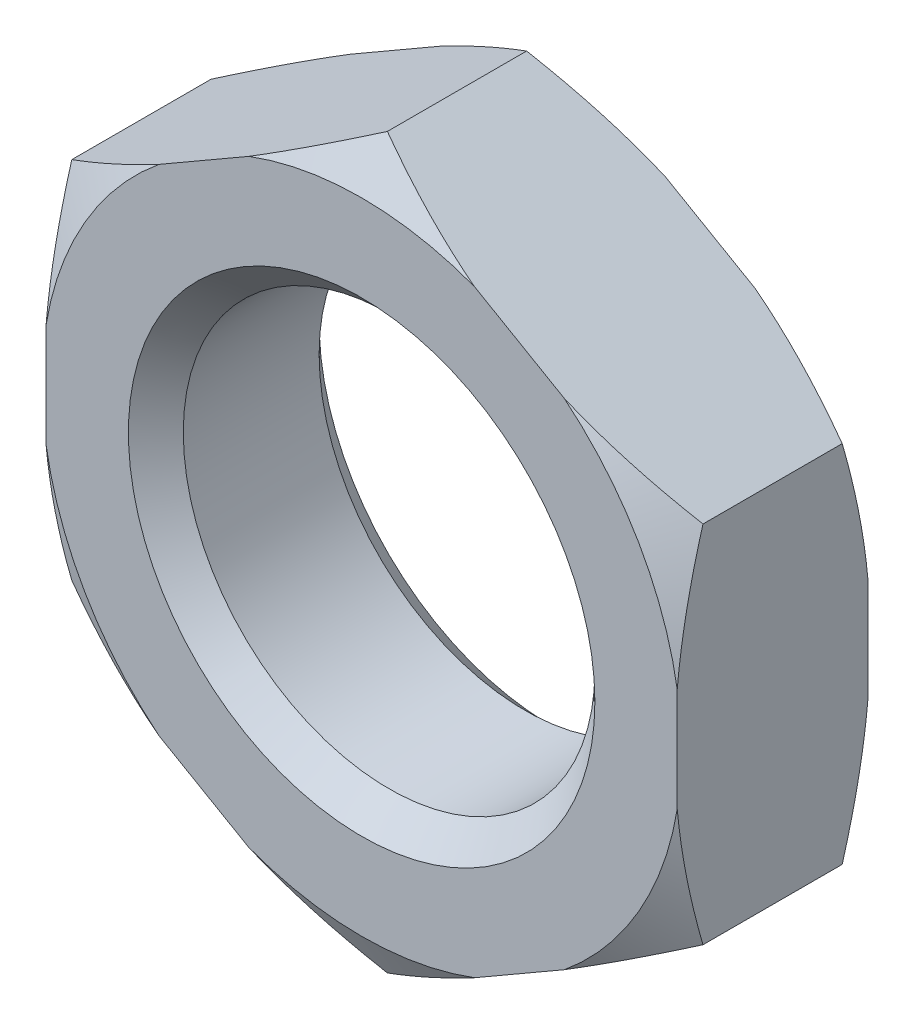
SolidWorks part; units mm, degrees
ref_plane "Front Plane" through (0, 0, 0) normal (0, 0, 1) x (1, 0, 0)
ref_plane "Top Plane" through (0, 0, 0) normal (0, 1, 0) x (1, 0, 0)
ref_plane "Right Plane" through (0, 0, 0) normal (1, 0, 0) x (0, 0, -1)
sketch "Sketch3" plane through (0, 0, 0) normal (0, 0, 1) x (1, 0, 0)
  line L1 (0, 26.5581) -> (-23, 13.2791)
  line L2 (-23, 13.2791) -> (-23, -13.2791)
  line L3 (-23, -13.2791) -> (0, -26.5581)
  line L4 (0, -26.5581) -> (23, -13.2791)
  line L5 (23, -13.2791) -> (23, 13.2791)
  line L6 (23, 13.2791) -> (0, 26.5581)
  circle A0 centre (0, 0) radius 23 construction
  dimension "D1" = 46
extrude "Boss-Extrude1" add sketch "Sketch3" along normal mid plane 13.9
sketch "Sketch4" plane through (0, 0, 0) normal (1, 0, 0) x (0, 0, -1)
  line L0 (-5.4578, 0) -> (6.1545, 0) construction
sketch "Sketch5" plane through (0, 0, 0) normal (1, 0, 0) x (0, 0, -1)
  line L0 (-6.95, 26.5581) -> (-6.95, 23.3081)
  line L1 (-6.95, 13.2791) -> (-6.95, 26.5581) construction
  line L2 (-6.95, 23.3081) -> (-5.0736, 26.5581)
  line L3 (-6.95, 26.5581) -> (6.95, 26.5581) construction
  line L4 (-5.0736, 26.5581) -> (-6.95, 26.5581)
  dimension "D1" = 3.25
  dimension "D2" = 30
revolve "Cut-Revolve1" cut sketch "Sketch5" angle 360 about L0
mirror "Mirror1" about plane through (0, 0, 0) normal (0, 0, 1) of "Cut-Revolve1"
sketch "Sketch6" plane through (0, 0, 6.95) normal (0, 0, 1) x (1, 0, 0)
  circle A0 centre (0, 0) radius 15
  dimension "D1" = 30
extrude "Cut-Extrude1" cut sketch "Sketch6" against normal blind 13.9
chamfer "Chamfer1" distance 2 angle 45 2 edges at (15, 0, -6.95) (15, 0, 6.95)
